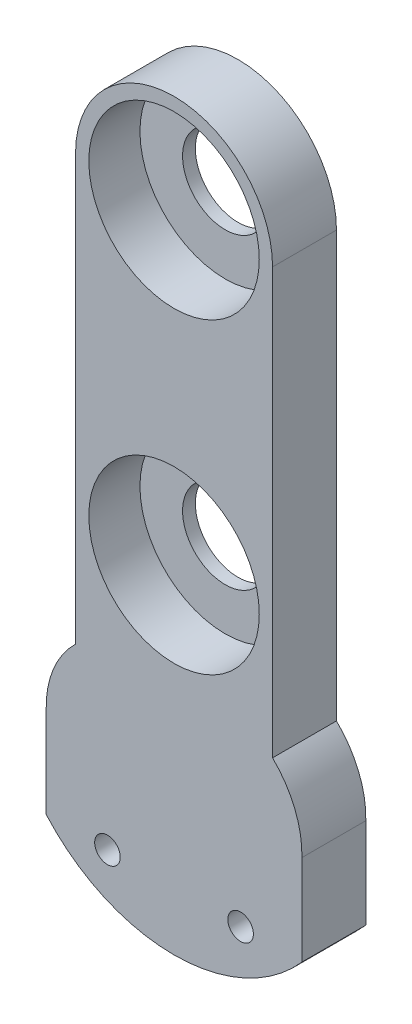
SolidWorks part; units mm, degrees
ref_plane "Front Plane" through (0, 0, 0) normal (0, 0, 1) x (1, 0, 0)
ref_plane "Top Plane" through (0, 0, 0) normal (0, 1, 0) x (1, 0, 0)
ref_plane "Right Plane" through (0, 0, 0) normal (1, 0, 0) x (0, 0, -1)
sketch "Sketch2" plane through (0, 0, 0) normal (0, 0, 1) x (1, 0, 0)
  line L0 (30, 107.4575) -> (30, 137.5775)
  line L2 (0, 0) -> (0, 21.2346)
  line L4 (60, 0) -> (60, 21.2346)
  line L9 (6.8855, 137.8208) -> (6.8855, 115.5577)
  line L10 (30, 66.4575) -> (30, -13.5425) construction
  line L11 (0, 10.6173) -> (60, 10.6173) construction
  line L12 (14.375, 0) -> (45.625, 0) construction
  line L13 (53.1145, 115.5577) -> (53.1145, 137.8208)
  line L14 (30, 160.9353) -> (30, 107.4575) construction
  line L15 (30, 66.4575) -> (30, -13.5425) construction
  line L16 (6.8855, 115.5577) -> (6.8855, 38.066)
  line L18 (53.1145, 38.066) -> (53.1145, 115.5577)
  arc A0 (0, 0) -> (60, 0) centre (30, 26.4575) ccw
  circle A2 centre (30, 137.5775) radius 20
  arc A3 (6.8855, 137.8208) -> (53.1145, 137.8208) centre (30, 137.8208) cw
  circle A7 centre (14.375, 0) radius 3
  circle A8 centre (45.625, 0) radius 3
  circle A10 centre (30, 66.4575) radius 20
  arc A11 (0, 21.2346) -> (6.8855, 38.066) centre (22.6351, 21.799) cw
  arc A12 (60, 21.2346) -> (53.1145, 38.066) centre (37.3649, 21.799) ccw
  dimension "D2" = 31.25
  dimension "D4" = 40
  dimension "D3" = 40
  dimension "D1" = 71.12
extrude "Boss-Extrude5" add sketch "Sketch2" along normal blind 15
sketch "Sketch3" plane through (0, 0, 15) normal (0, 0, 1) x (1, 0, 0)
  line L0 (30, 137.8208) -> (30, 65.7008) construction
  circle A0 centre (30, 137.8208) radius 20
  circle A1 centre (30, 65.7008) radius 20
  dimension "D1" = 72.12
extrude "Cut-Extrude1" cut sketch "Sketch3" against normal blind 12
sketch "Sketch4" plane through (0, 0, 15) normal (0, 0, 1) x (1, 0, 0)
  circle A0 centre (30, 137.8208) radius 10
  circle A1 centre (30, 65.7008) radius 10
extrude "Cut-Extrude2" cut sketch "Sketch4" against normal blind 15
